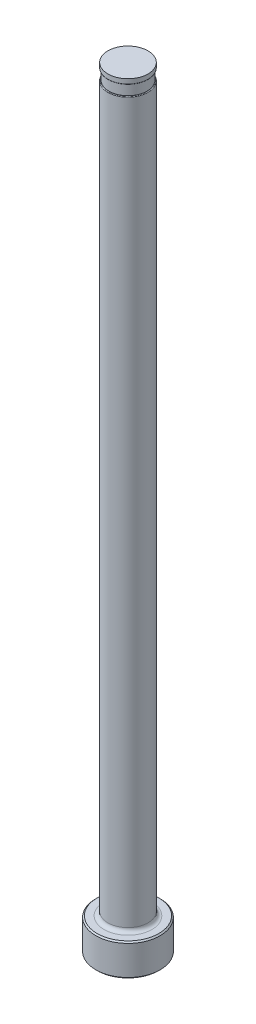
SolidWorks part; units mm, degrees
ref_plane "Front Plane" through (0, 0, 0) normal (0, 0, 1) x (1, 0, 0)
ref_plane "Top Plane" through (0, 0, 0) normal (0, 1, 0) x (1, 0, 0)
ref_plane "Right Plane" through (0, 0, 0) normal (1, 0, 0) x (0, 0, -1)
other "Configuration Table"
sketch "Sketch1" plane through (0, 0, 0) normal (0, 0, 1) x (1, 0, 0)
  line L0 (0, 259.9588) -> (0, -15.1925) construction
  line L1 (0, 0) -> (-6.35, 0)
  line L2 (-6.35, 0) -> (-6.35, 6.35)
  line L3 (-6.35, 6.35) -> (-3.9687, 6.35)
  line L4 (-3.9687, 6.35) -> (-3.9687, 152.4)
  line L5 (-3.9687, 152.4) -> (0, 152.4)
  line L6 (0, 152.4) -> (0, 0)
  dimension "L" = 152.4
  dimension "H" = 12.7
  dimension "T" = 6.35
  dimension "D" = 7.9375
revolve "Revolve1" add sketch "Sketch1" angle 360 about L0
chamfer "Chamfer1" distance 0.254 angle 45 2 edges at (0, 6.35, 6.35) (0, 0, 6.35)
fillet "Fillet1" radius 0.762 1 edges at (0, 6.35, 3.9687)
sketch "Sketch2" plane through (0, 0, 0) normal (0, 0, 1) x (1, 0, 0)
  line L0 (-3.9687, 152.4) -> (-3.9687, 7.112) construction
  line L1 (-3.9687, 151.384) -> (-3.7655, 151.384)
  line L2 (-3.9687, 151.384) -> (-3.9687, 149.352)
  line L3 (-3.9687, 149.352) -> (-3.7655, 149.352)
  line L4 (-3.7655, 151.384) -> (-3.7655, 149.352)
  line L5 (3.9687, 152.4) -> (-3.9687, 152.4) construction
  line L6 (0, 153.4483) -> (0, 147.3282) construction
  dimension "D1" = 2.032
  dimension "N" = 1.016
  dimension "FD" = 0.2032
  dimension "D3" = 7.5311
revolve "Vent Relief" cut sketch "Sketch2" angle 360 about L6
sketch "Sketch3" plane through (0, 0, 0) normal (0, 0, 1) x (1, 0, 0)
  line L0 (-3.7655, 150.368) -> (-3.7655, 86.868)
  line L1 (-3.7655, 151.384) -> (-3.7655, 149.352) construction
  line L2 (-3.9687, 149.352) -> (-3.9687, 7.112) construction
  line L3 (-3.9687, 85.7504) -> (-3.9687, 150.368)
  line L4 (-3.9687, 150.368) -> (-3.7655, 150.368)
  arc A0 (-3.7655, 86.868) -> (-3.9687, 85.7504) centre (-6.9405, 86.868) cw
  dimension "D1" = 3.175
  dimension "D2" = 63.5
extrude "D-Slot" cut sketch "Sketch3" against normal through all both and the other way through all
sketch "Sketch5" plane through (0, 0, 0) normal (0, 0, 1) x (1, 0, 0)
  line L0 (-3.9687, 151.384) -> (3.9687, 151.384) construction
  line L1 (-3.9687, 152.4) -> (-3.9637, 152.4)
  line L2 (-3.9687, 152.4) -> (-3.9687, 151.384)
  line L3 (-3.9687, 151.384) -> (-3.9637, 151.384)
  line L4 (-3.9637, 152.4) -> (-3.9637, 151.384)
  line L5 (0, 152.6877) -> (0, 150.5771) construction
  dimension "VP" = 0.0051
revolve "Vent Diameter" cut sketch "Sketch5" angle 360 about L5
fillet "Fillet2" radius 0.127 2 edges at (3.9687, 149.352, 0) (0, 151.384, 3.9637)
sketch "Pocket Sketch" plane through (0, 0, 0) normal (0, 0, 1) x (1, 0, 0)
  line L0 (-6.7469, 0) -> (-6.7469, 6.3754)
  line L1 (-6.7469, 6.3754) -> (-4.9292, 6.3754)
  line L2 (-4.1672, 7.1374) -> (-4.1672, 22.225)
  line L3 (-4.1672, 22.225) -> (0, 22.225)
  line L4 (0, 22.225) -> (0, 0)
  line L5 (0, 0) -> (-6.7469, 0)
  line L6 (0, 12.6104) -> (0, -2.4989) construction
  line L7 (-6.35, 6.096) -> (-6.35, 0.254) construction
  line L8 (6.096, 6.35) -> (-6.096, 6.35) construction
  line L9 (-3.9687, 85.7504) -> (-3.9687, 7.112) construction
  line L10 (-4.9292, 6.3754) -> (-4.1672, 7.1374)
  point P3 (-4.1672, 6.3754)
  dimension "D1" = 13.4937
  dimension "D2" = 0.3969
  dimension "D3" = 0.0254
  dimension "D4" = 0.1984
  dimension "D5" = 8.3344
  dimension "D6" = 22.225
